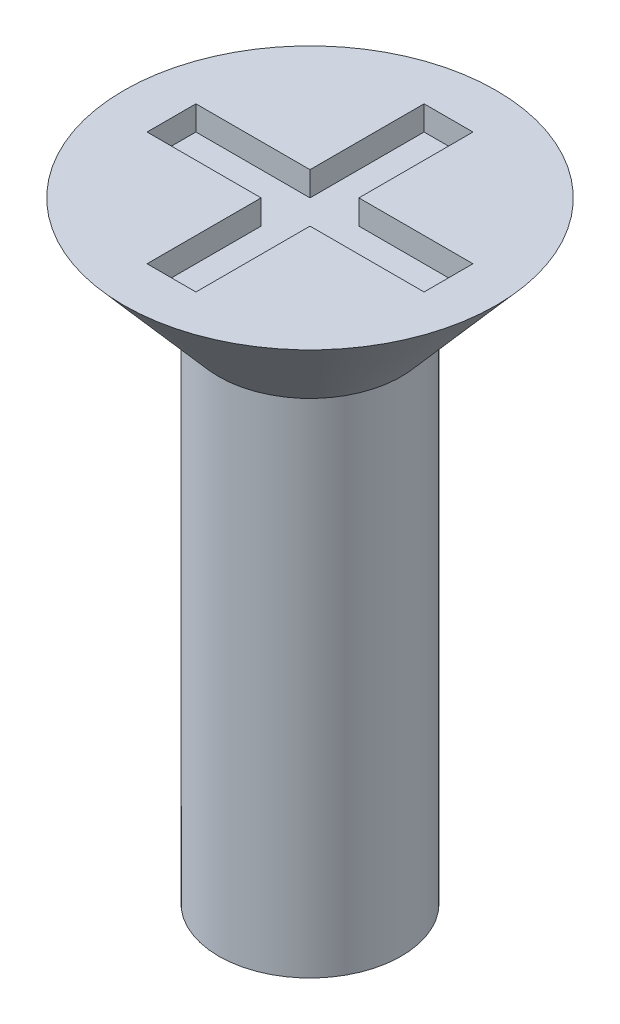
SolidWorks part; units mm, degrees
ref_plane " FRONT" through (0, 0, 0) normal (0, 0, 1) x (1, 0, 0)
ref_plane "TOP" through (0, 0, 0) normal (0, 1, 0) x (1, 0, 0)
ref_plane "SIDE" through (0, 0, 0) normal (1, 0, 0) x (0, 0, -1)
sketch "Sketch1" plane through (0, 0, 0) normal (0, 0, 1) x (1, 0, 0)
  line L0 (0, 90.8693) -> (0, -44.7514) construction
  line L1 (0, 0) -> (1.4224, 0)
  line L2 (1.4224, 0) -> (1.4224, 7.8232)
  line L3 (1.4224, 7.8232) -> (2.9018, 9.525)
  line L4 (2.9018, 9.525) -> (0, 9.525)
  line L5 (0, 0) -> (0, 9.525)
  dimension "ThreadDia" = 2.8448
  dimension "D1" = 139
  dimension "HeadHeight" = 1.7018
  dimension "TotalLength" = 9.525
revolve "FLATHEAD" add sketch "Sketch1" angle 360 about L0
sketch "Sketch2" plane through (0, 9.525, 0) normal (0, 1, 0) x (-1, 0, 0)
  line L0 (-0.381, 0) -> (0.381, 0)
  line L1 (-0.381, 0) -> (-0.381, 2.159)
  line L2 (0.381, 2.159) -> (-0.381, 2.159)
  line L3 (0.381, 2.159) -> (0.381, 0)
  line L4 (0, 50) -> (0, -50) construction
  line L5 (50, 0) -> (-50, 0) construction
  dimension "PhillipsWidth" = 0.762
  dimension "D2" = 0.381
  dimension "1/2PhillipsLength" = 2.159
extrude "PHILLIPS" cut sketch "Sketch2" against normal blind 0.381
pattern_circular "PHILLIPS PATTERN" count 4 every 90 about axis through (0, 0, 0) along (0, 1, 0) of "PHILLIPS"
equation "\"D2@Sketch2\" = \"PhillipsWidth@Sketch2\" * .5"
